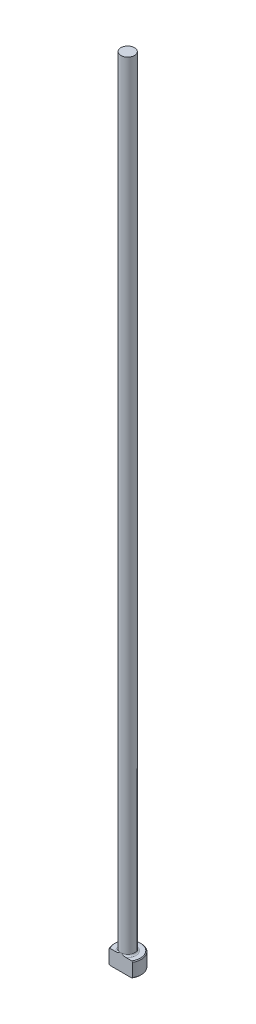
SolidWorks part; units mm, degrees
ref_plane "Front Plane" through (0, 0, 0) normal (0, 0, 1) x (1, 0, 0)
ref_plane "Top Plane" through (0, 0, 0) normal (0, 1, 0) x (1, 0, 0)
ref_plane "Right Plane" through (0, 0, 0) normal (1, 0, 0) x (0, 0, -1)
sketch "Sketch1" plane through (0, 0, 0) normal (0, 0, 1) x (1, 0, 0)
  line L0 (0, 259.9588) -> (0, -15.1925) construction
  line L1 (0, 0) -> (-4.3561, 0)
  line L2 (-4.3561, 0) -> (-4.3561, 4.7498)
  line L3 (-4.3561, 4.7498) -> (-2.1819, 4.7498)
  line L4 (-2.1819, 4.7498) -> (-2.1819, 254)
  line L5 (-2.1819, 254) -> (0, 254)
  line L6 (0, 254) -> (0, 0)
  dimension "L" = 254
  dimension "H" = 8.7122
  dimension "T" = 4.7498
  dimension "D" = 4.3637
revolve "Revolve1" add sketch "Sketch1" angle 360 about L0
chamfer "Chamfer1" distance 0.254 angle 45 2 edges at (0, 4.7498, 4.3561) (0, 0, 4.3561)
fillet "Fillet1" radius 0.508 1 edges at (0, 4.7498, 2.1819)
sketch "Sketch2" plane through (0, 0, 0) normal (0, 1, 0) x (1, 0, 0)
  line L0 (-3.7703, -2.1819) -> (3.7703, -2.1819)
  circle A0 centre (0, 0) radius 4.3561 construction
  arc A1 (-3.7703, -2.1819) -> (3.7703, -2.1819) centre (0, 0) ccw
  circle A3 centre (0, 0) radius 2.1819 construction
  dimension "D1" = 0
extrude "Key" cut sketch "Sketch2" along normal through all
sketch "Pocket Sketch" plane through (0, 0, 0) normal (0, 0, 1) x (1, 0, 0)
  line L0 (-4.753, 0) -> (-4.753, 4.7752)
  line L1 (-4.753, 4.7752) -> (-3.1423, 4.7752)
  line L2 (-2.3803, 5.5372) -> (-2.3803, 22.225)
  line L3 (-2.3803, 22.225) -> (0, 22.225)
  line L4 (0, 22.225) -> (0, 0)
  line L5 (0, 0) -> (-4.753, 0)
  line L6 (0, 12.6104) -> (0, -2.4989) construction
  line L7 (-4.3561, 4.4958) -> (-4.3561, 0.254) construction
  line L8 (4.1021, 4.7498) -> (-4.1021, 4.7498) construction
  line L9 (-2.1819, 254) -> (-2.1819, 5.2578) construction
  line L10 (-3.1423, 4.7752) -> (-2.3803, 5.5372)
  point P3 (-2.3803, 4.7752)
  dimension "D1" = 9.5059
  dimension "D2" = 0.3969
  dimension "D3" = 0.0254
  dimension "D4" = 0.1984
  dimension "D5" = 4.7606
  dimension "D6" = 22.225
